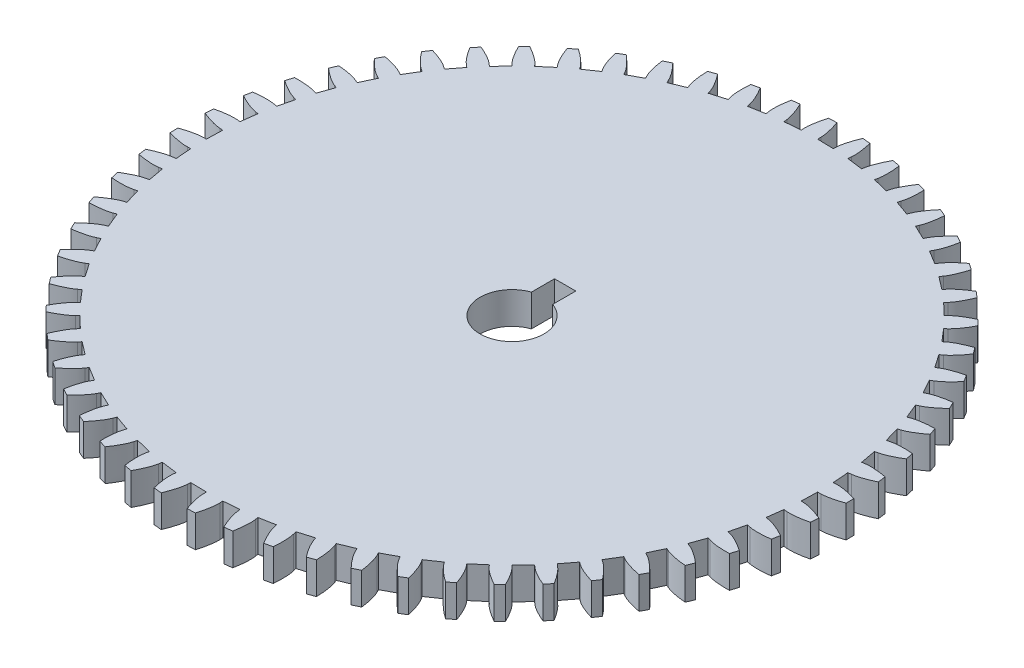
SolidWorks part; units mm, degrees
ref_plane "Front Plane" through (0, 0, 0) normal (0, 0, 1) x (1, 0, 0)
ref_plane "Top Plane" through (0, 0, 0) normal (0, 1, 0) x (1, 0, 0)
ref_plane "Right Plane" through (0, 0, 0) normal (1, 0, 0) x (0, 0, -1)
sketch "Sketch1" plane through (0, 0, 0) normal (0, 1, 0) x (1, 0, 0)
  line L0 (0, 0) -> (0, 14.5222) construction
  line L1 (0, 0) -> (-14.5222, 0) construction
  line L2 (0, 0) -> (-15.4947, -0.4057) construction
  line L3 (0, 0) -> (-14.5023, -0.76) construction
  line L4 (0, 0) -> (-14.4427, -1.518) construction
  circle A0 centre (0, 0) radius 15 construction
  circle A1 centre (0, 0) radius 14.5222 construction
  circle A2 centre (0, 0) radius 14.375 construction
  circle A3 centre (0, 0) radius 15.5 construction
  spline S0 degree 4 poles (-14.5222, 0) (-14.5474, 0) (-14.6179, -0.0026) (-14.7508, -0.0177) (-14.9656, -0.0568) (-15.2352, -0.1274) (-15.5771, -0.2425) (-15.9699, -0.4077) (-16.3888, -0.6197) (-16.8288, -0.8819) (-17.2522, -1.1709) (-17.6587, -1.4833) (-18.0484, -1.8162) (-18.5012, -2.2426) (-19.0162, -2.7882) (-19.5743, -3.4671) (-20.1529, -4.291) (-20.6802, -5.1708) (-21.1469, -6.0836) (-21.5035, -6.9074) (-21.773, -7.6266) (-21.9741, -8.236) (-22.1209, -8.7246) (-22.2874, -9.3478) (-22.4308, -9.9638) (-22.5527, -10.6055) (-22.6716, -11.3455) (-22.7509, -12.0161) (-22.806, -12.5943) (-22.8507, -13.4193) (-22.8604, -13.7954) (-22.8666, -14.374) (-22.8585, -14.6717) (-22.8548, -14.932) (-22.8482, -15.0561) (-22.8445, -15.1782) (-22.8421, -15.2291) knots 0 0 0 0 0 0.005377 0.015084 0.028532 0.04661 0.064855 0.092111 0.119476 0.146842 0.174209 0.201575 0.228941 0.256307 0.307035 0.361767 0.4165 0.471232 0.525964 0.580697 0.608063 0.635429 0.662795 0.690161 0.744894 0.77226 0.799626 0.854358 0.881725 0.909091 0.954545 0.965909 0.977273 0.988636 1 1 1 1 1 construction
  spline S1 degree 4 poles (-14.5222, 0) (-14.5474, 0) (-14.6179, -0.0026) (-14.7508, -0.0177) (-14.9656, -0.0568) (-15.2352, -0.1274) (-15.5771, -0.2425) (-15.9699, -0.4077) (-16.3888, -0.6197) (-16.8288, -0.8819) (-17.2522, -1.1709) (-17.6587, -1.4833) (-18.0484, -1.8162) (-18.5012, -2.2426) (-19.0162, -2.7882) (-19.5743, -3.4671) (-20.1529, -4.291) (-20.6802, -5.1708) (-21.1469, -6.0836) (-21.5035, -6.9074) (-21.773, -7.6266) (-21.9741, -8.236) (-22.1209, -8.7246) (-22.2874, -9.3478) (-22.4308, -9.9638) (-22.5527, -10.6055) (-22.6716, -11.3455) (-22.7509, -12.0161) (-22.806, -12.5943) (-22.8376, -13.1773) (-22.8474, -13.4103) (-22.8512, -13.5267) knots 0 0 0 0 0 0.005377 0.015084 0.028532 0.04661 0.064855 0.092111 0.119476 0.146842 0.174209 0.201575 0.228941 0.256307 0.307035 0.361767 0.4165 0.471232 0.525964 0.580697 0.608063 0.635429 0.662795 0.690161 0.744894 0.77226 0.799626 0.854358 0.881725 0.909091 0.909091 0.909091 0.909091 0.909091
  dimension "D1" = 31
  dimension "D2" = 30
  dimension "D3" = 29.0444
  dimension "D4" = 28.75
  dimension "D5" = 14.5222
  dimension "D6" = 1.5
  dimension "D7" = 3
  dimension "D8" = 6
sketch "Sketch2" plane through (0, 0, 0) normal (0, 1, 0) x (1, 0, 0)
  line L0 (0, 0) -> (-15.4947, -0.4057) construction
  line L1 (0, 0) -> (-15.4947, -0.4057) construction
  line L2 (0, 0) -> (-14.5023, -0.76) construction
  line L3 (0, 0) -> (-14.5222, 0) construction
  line L4 (0, 0) -> (-14.4427, -1.518) construction
  line L5 (0, 0) -> (-14.5023, -0.76) construction
  line L6 (0, 0) -> (-14.5222, 0) construction
  line L7 (0, 0) -> (-14.4427, -1.518) construction
  line L8 (-14.5023, -0.76) -> (-14.3553, -0.7523)
  line L9 (-14.3553, -0.7523) -> (-14.2963, -1.5026)
  line L10 (-14.2963, -1.5026) -> (-14.4427, -1.518) construction
  line L11 (-14.2963, -1.5026) -> (-1.4918, -0.1568)
  line L12 (-14.5222, 0) -> (-1.5, 0)
  circle A0 centre (0, 0) radius 14.375 construction
  circle A1 centre (0, 0) radius 14.5222 construction
  circle A2 centre (0, 0) radius 15 construction
  circle A3 centre (0, 0) radius 15.5 construction
  circle A4 centre (0, 0) radius 14.375 construction
  circle A5 centre (0, 0) radius 14.5222 construction
  circle A6 centre (0, 0) radius 15 construction
  circle A7 centre (0, 0) radius 15.5 construction
  arc A8 (-15.4887, -0.5918) -> (-15.4984, -0.2196) centre (0, 0) cw
  circle A11 centre (0, 0) radius 1.5 construction
  arc A12 (-1.5, 0) -> (-1.4918, -0.1568) centre (0, 0) ccw
  spline S0 degree 4 poles (-41.8456, -999.6256) (-10.8592, -25.7627) (-11.8078, -0.5858) (-13.4317, 0.2222) (-14.9656, -0.0568) (-15.2352, -0.1274) (-15.5771, -0.2425) (-15.9699, -0.4077) (-16.3888, -0.6197) (-16.8288, -0.8819) (-17.2522, -1.1709) (-17.6587, -1.4833) (-18.0484, -1.8162) (-18.5012, -2.2426) (-19.0162, -2.7882) (-19.5743, -3.4671) (-20.1529, -4.291) (-20.6802, -5.1708) (-21.1469, -6.0836) (-21.5035, -6.9074) (-21.773, -7.6266) (-21.9741, -8.236) (-22.1209, -8.7246) (-22.2874, -9.3478) (-22.4308, -9.9638) (-22.5527, -10.6055) (-22.6716, -11.3455) (-22.7509, -12.0161) (-22.955, -14.1567) (-22.908, -18.4893) (-21.3332, 17.159) (-55.0589, -1012.9521) knots -0.286294 -0.286294 -0.286294 -0.286294 -0.286294 0.005377 0.015084 0.028532 0.04661 0.064855 0.092111 0.119476 0.146842 0.174209 0.201575 0.228941 0.256307 0.307035 0.361767 0.4165 0.471232 0.525964 0.580697 0.608063 0.635429 0.662795 0.690161 0.744894 0.77226 0.799626 0.854358 0.881725 1.278839 1.278839 1.278839 1.278839 1.278839 only from (-14.5222, 0) to (-22.8512, -13.5267) construction
  spline S1 degree 4 poles (-14.5222, 0) (-14.5474, 0) (-14.6179, -0.0026) (-14.7508, -0.0177) (-14.9656, -0.0568) (-15.1845, -0.1141) (-15.3565, -0.1691) (-15.4674, -0.2083) (-15.4984, -0.2196) knots 0 0 0 0 0 0.005377 0.015084 0.028532 0.04661 0.053662 0.053662 0.053662 0.053662 0.053662
  spline S2 degree 4 poles (-14.5023, -0.76) (-14.5275, -0.7614) (-14.5981, -0.7625) (-14.7315, -0.7543) (-14.9481, -0.7266) (-15.1696, -0.6807) (-15.3443, -0.6348) (-15.4571, -0.6015) (-15.4887, -0.5918) knots 0 0 0 0 0 0.005377 0.015084 0.028532 0.04661 0.053662 0.053662 0.053662 0.053662 0.053662
  point P21 (-14.3553, -0.7523)
  point P24 (-14.2963, -1.5026)
  dimension "D2" = 3
extrude "Boss-Extrude1" add sketch "Sketch2" along normal blind 1.5
pattern_circular "CirPattern1" count 60 over 360 of "Boss-Extrude1"
sketch "Sketch3" plane through (0, 1.5, 0) normal (0, 1, 0) x (1, 0, 0)
  line L1 (0.5, 0.5) -> (-0.5, 0.5)
  line L2 (0.5, 0.5) -> (0.5, 2.5)
  line L3 (0.5, 2.5) -> (-0.5, 2.5)
  line L4 (-0.5, 0.5) -> (-0.5, 2.5)
  line L5 (0.5, 0.5) -> (-0.5, 2.5) construction
  line L6 (0.5, 2.5) -> (-0.5, 0.5) construction
  circle A0 centre (0, 0) radius 1.5 construction
  point P0 (0, 1.5)
  dimension "D1" = 2
  dimension "D2" = 1
extrude "Cut-Extrude1" cut sketch "Sketch3" against normal up to surface (1.5 mm away)
equation "\"Module\"= .5"
equation "\"Number of Teeth\" = 60"
equation "\"Pressure Angle\"= 14.5deg"
equation "\"Pitch Diameter\"= \"Number of Teeth\" * \"Module\""
equation "\"Circular Pitch\"= pi * \"Module\""
equation "\"Addendum\"= \"Module\""
equation "\"Dedendum\"= 1.25 * \"Module\""
equation "\"Base Diameter\"= \"Pitch Diameter\" * cos ( \"Pressure Angle\" )"
equation "\"Base Radius\"= \"Base Diameter\" / 2"
equation "\"Width\"= 1.5"
equation "\"Outside Diameter\"= \"Pitch Diameter\" + 2 * \"Addendum\""
equation "\"D1@Sketch1\"=\"Outside Diameter\""
equation "\"D3@Sketch1\"=\"Base Diameter\""
equation "\"Root Diameter\"= \"Pitch Diameter\" - 2 * \"Dedendum\""
equation "\"D4@Sketch1\"=\"Root Diameter\""
equation "\"Tooth Angle\"= 360 / \"Number of Teeth\""
equation "\"D6@Sketch1\"=\"Tooth Angle\"/4"
equation "\"D7@Sketch1\"=\"Tooth Angle\"/2"
equation "\"D8@Sketch1\"=\"Tooth Angle\""
equation "\"D2@Sketch1\" = \"Pitch Diameter\""
equation "\"Shaft Diameter\"= 3"
equation "\"D1@CirPattern1\" = \"Number of Teeth\""
equation "\"D2@Sketch2\"= \"Shaft Diameter\""
equation "\"D1@Boss-Extrude1\" = \"Width\""
